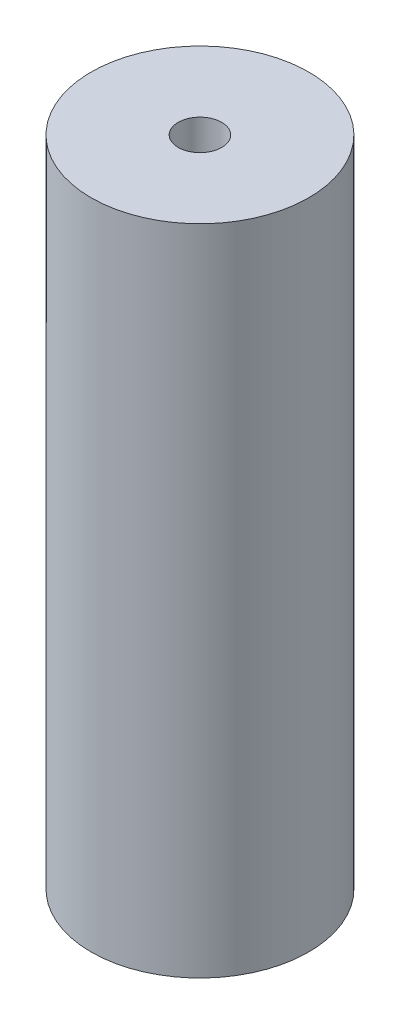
SolidWorks part; units mm, degrees
ref_plane "Front Plane" through (0, 0, 0) normal (0, 0, 1) x (1, 0, 0)
ref_plane "Top Plane" through (0, 0, 0) normal (0, 1, 0) x (1, 0, 0)
ref_plane "Right Plane" through (0, 0, 0) normal (1, 0, 0) x (0, 0, -1)
sketch "Sketch1" plane through (0, 0, 0) normal (0, 1, 0) x (1, 0, 0)
  circle A0 centre (0, 0) radius 10
  dimension "D1" = 20
extrude "Extrude1" add sketch "Sketch1" along normal blind 60
hole_wizard "Ø4.0 (4) Diameter Hole1" positions "3DSketch1" profile "Sketch3" hole size "Ø4.0" standard "ISO"
sketch3d "3DSketch1"
  line L0 (0, 60, 0) -> (0, 0, 0) construction
  point P0 (0, 60, 0)
sketch "Sketch3" plane through (0, 60, 0) normal (1, 0, 0) x (0, 0, 1)
  line L0 (0, 0) -> (0, 26.2017)
  line L1 (0, 26.2017) -> (2, 25)
  line L2 (2, 25) -> (2, 0)
  line L5 (2, 0) -> (0, 0)
  line L10 (0, 26.2017) -> (-2, 25) construction
  line L11 (0, -6.35) -> (0, 107.95) construction
  dimension "Hole Dia." = 4
  dimension "Hole Depth" = 25
  dimension "Drill Angle" = 118
